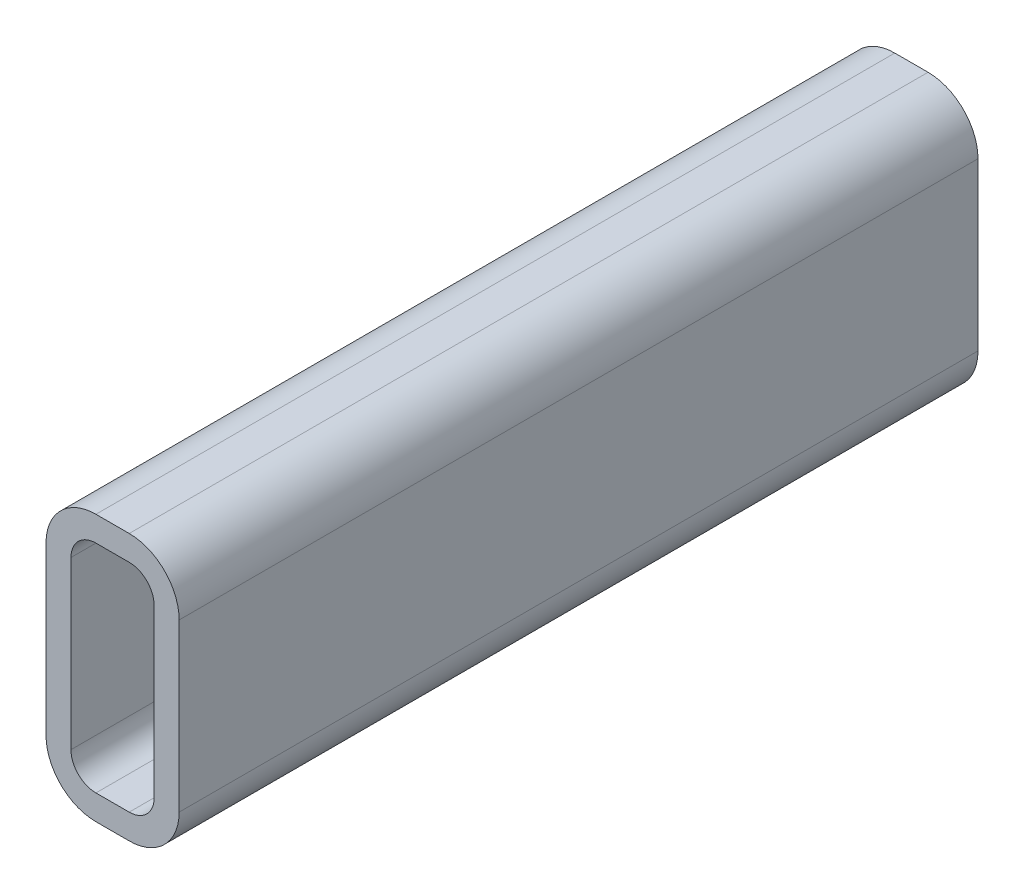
SolidWorks part; units mm, degrees
ref_plane "Front Plane" through (0, 0, 0) normal (0, 0, 1) x (1, 0, 0)
ref_plane "Top Plane" through (0, 0, 0) normal (0, 1, 0) x (1, 0, 0)
ref_plane "Right Plane" through (0, 0, 0) normal (1, 0, 0) x (0, 0, -1)
sketch "Sketch1" plane through (0, 0, 0) normal (0, 0, 1) x (1, 0, 0)
  line B0 (19.05, 101.6) -> (31.75, 101.6)
  arc B1 (50.8, 82.55) -> (31.75, 101.6) centre (31.75, 82.55) ccw
  line B2 (50.8, 82.55) -> (50.8, 19.05)
  arc B3 (31.75, 0) -> (50.8, 19.05) centre (31.75, 19.05) ccw
  line B4 (31.75, 0) -> (19.05, 0)
  arc B5 (0, 19.05) -> (19.05, 0) centre (19.05, 19.05) ccw
  line B6 (0, 19.05) -> (0, 82.55)
  arc B7 (19.05, 101.6) -> (0, 82.55) centre (19.05, 82.55) ccw
  line B8 (19.05, 92.075) -> (31.75, 92.075)
  arc B9 (41.275, 82.55) -> (31.75, 92.075) centre (31.75, 82.55) ccw
  line B10 (41.275, 82.55) -> (41.275, 19.05)
  arc B11 (31.75, 9.525) -> (41.275, 19.05) centre (31.75, 19.05) ccw
  line B12 (31.75, 9.525) -> (19.05, 9.525)
  arc B13 (9.525, 19.05) -> (19.05, 9.525) centre (19.05, 19.05) ccw
  line B14 (9.525, 19.05) -> (9.525, 82.55)
  arc B15 (19.05, 92.075) -> (9.525, 82.55) centre (19.05, 82.55) ccw
sketch_block_instance "HSS4x2x0.375-1"
sketch_block "HSS4x2x0.375"
extrude "Boss-Extrude1" add sketch "Sketch1" along normal blind 304.8
